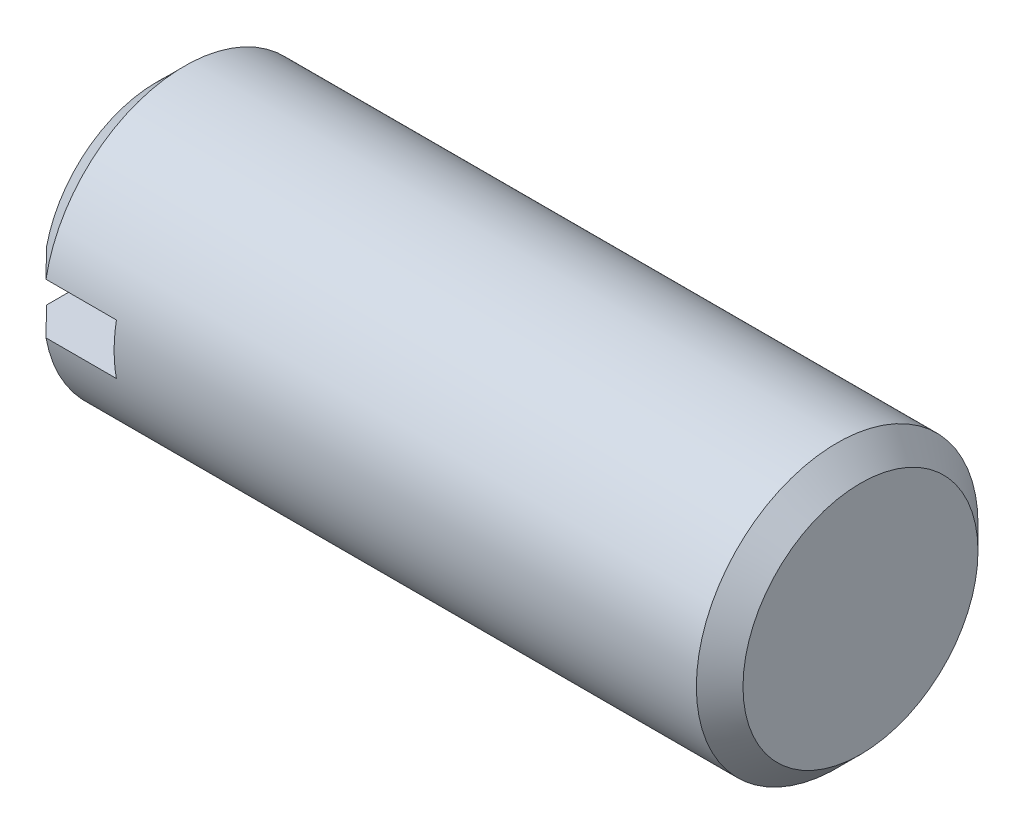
SolidWorks part; units mm, degrees
ref_plane "Plane1" through (0, 0, 0) normal (0, 0, 1) x (1, 0, 0)
ref_plane "Plane2" through (0, 0, 0) normal (0, 1, 0) x (1, 0, 0)
ref_plane "Plane3" through (0, 0, 0) normal (1, 0, 0) x (0, 0, -1)
sketch "BodySke" plane through (0, 0, 0) normal (0, 0, 1) x (1, 0, 0)
  line L0 (0, 0) -> (0, 4)
  line L1 (0, 4) -> (1, 5)
  line L3 (1, 5) -> (24.172, 5)
  line L4 (25, 4.172) -> (25, 0)
  line L5 (25, 0) -> (0, 0)
  line L6 (-3.6761, 0) -> (29.1174, 0) construction
  line L8 (25, 4.172) -> (24.172, 5)
  line L10 (25, -4.172) -> (24.172, -5) construction
  line L11 (1.5, 4.525) -> (1.5, -1.825) construction
  line L12 (13, 4.525) -> (13, -1.825) construction
  line L13 (9, 4.525) -> (9, -1.825) construction
  dimension "D2" = 45
  dimension "Diameter" = 10
  dimension "D4" = 4
  dimension "Length" = 25
  dimension "Body_ch_ang" = 45
  dimension "Minor_dia" = 8.344
  dimension "Advance" = 1.5
  dimension "Thread_nom" = 12
  dimension "Thread_length" = 16
revolve "Base-Revolve" add sketch "BodySke"
extrude "Slot" cut sketch "SlotSke" against normal through all and the other way through all
sketch "SlotSke" plane through (0, 0, 0) normal (0, 0, 1) x (1, 0, 0)
  line L1 (-0.9887, 0) -> (5.0854, 0) construction
  line L2 (-3.6761, 0) -> (29.1174, 0) construction
  line L3 (0, 4) -> (0, -4) construction
  line L4 (0, 0.9) -> (3.5, 0.9)
  line L5 (0, 0.9) -> (0, -0.9)
  line L6 (0, -0.9) -> (3.5, -0.9)
  line L7 (3.5, 0.9) -> (3.5, -0.9)
  dimension "Slot_wid" = 1.8
  dimension "Slot_Dep" = 3.5
sketch "ThdSchSke" plane through (0, 0, 0) normal (0, 0, 1) x (1, 0, 0)
  line L0 (13, -4.172) -> (12.4202, -5)
  line L1 (13, -4.172) -> (13.5798, -5)
  line L2 (13.5798, -5) -> (13.5798, -6.25)
  line L3 (-3.175, 0) -> (5.1513, 0) construction
  line L5 (13.5798, -6.25) -> (12.4202, -6.25)
  line L6 (12.4202, -6.25) -> (12.4202, -5)
  dimension "Thread_minor" = 8.344
  dimension "Diameter" = 10
  dimension "Start" = 13
  dimension "SideAngle" = 55
  dimension "VeeAngle" = 70
  dimension "Overcut" = 12.5
revolve "ThreadSchematic" [suppressed] cut sketch "ThdSchSke" angle 360 about L3
pattern_linear "ThdSchPat" [suppressed]
equation "\"Thread_minor@ThreadCosmetic\"  =  \"Minor_dia@BodySke\""
equation "\"D4@BodySke\" = \"Diameter@BodySke\" * 0.4"
equation "\"Thread_length@ThreadCosmetic\" = ((sgn( (\"Length@BodySke\" - \"Advance@BodySke\" * 1.5  ) - \"Thread_nom@BodySke\" )-1)*( (\"Length@BodySke\" - \"Advance@BodySke\" * 1.5 ) - \"Thread_nom@BodySke\" ))/-2+ \"Thread"
equation "\"Thread_minor@ThdSchSke\" = \"Minor_dia@BodySke\""
equation "\"Diameter@ThdSchSke\" = \"Diameter@BodySke\""
equation "\"Overcut@ThdSchSke\" = \"Diameter@BodySke\" * 1.25"
equation "\"Start@ThdSchSke\" = 0.000001 + \"Length@BodySke\" - \"Thread_length@ThreadCosmetic\"  '---Countersunk---"
equation "\"Num_threads@ThdSchPat\" = int( \"Thread_length@ThreadCosmetic\" / \"Advance@BodySke\" + 0.999 )  + 1"
equation "\"Advance@ThdSchPat\" = \"Thread_length@ThreadCosmetic\" /  (\"Num_threads@ThdSchPat\" - 1) 'relax it"
equation "\"Num_threads@ThdSchPat\" = \"Num_threads@ThdSchPat\" - sgn( \"Num_threads@ThdSchPat\" - 1) '---chamfered tips only---"
